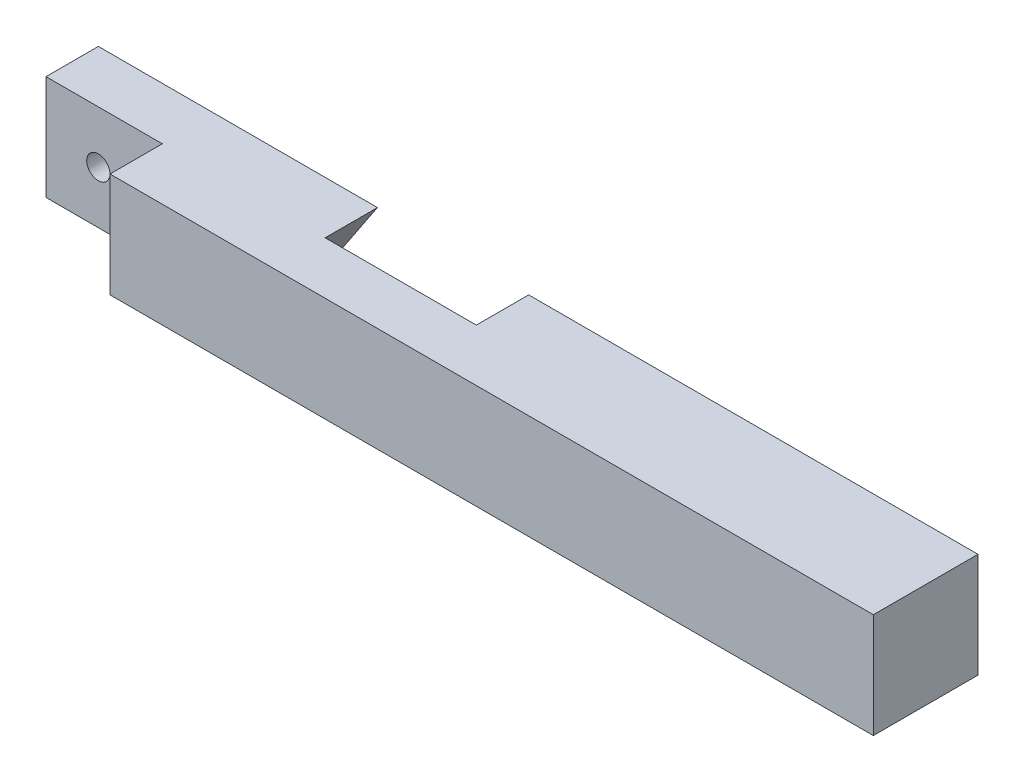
SolidWorks part; units mm, degrees
ref_plane "Plan de face" through (0, 0, 0) normal (0, 0, 1) x (1, 0, 0)
ref_plane "Plan de dessus" through (0, 0, 0) normal (0, 1, 0) x (1, 0, 0)
ref_plane "Plan de droite" through (0, 0, 0) normal (1, 0, 0) x (0, 0, -1)
sketch "Esquisse1" plane through (0, 0, 0) normal (0, 0, 1) x (1, 0, 0)
  line L1 (0, 0) -> (75.63, 0)
  line L2 (0, 0) -> (0, 9)
  line L3 (0, 9) -> (75.63, 9)
  line L4 (75.63, 0) -> (75.63, 9)
  dimension "D1" = 75.63
  dimension "D2" = 9
extrude "Extrusion1" add sketch "Esquisse1" along normal blind 9
sketch "Esquisse2" plane through (0, 0, 9) normal (0, 0, 1) x (1, 0, 0)
  line L0 (0, 0) -> (75.63, 0) construction
  line L1 (0, 9) -> (10, 9)
  line L2 (0, 9) -> (0, 0)
  line L3 (0, 0) -> (10, 0)
  line L4 (10, 9) -> (10, 0)
  dimension "D1" = 10
extrude "Enlèv. mat.-Extru.1" cut sketch "Esquisse2" against normal blind 4.5
sketch "Esquisse3" plane through (0, 0, 4.5) normal (0, 0, 1) x (1, 0, 0)
  line L0 (0, 9) -> (0, 0) construction
  line L1 (0, 0) -> (10, 0) construction
  circle A0 centre (4.5, 4.5) radius 1
  dimension "D3" = 2
  dimension "D1" = 4.5
  dimension "D2" = 4.5
extrude "Enlèv. mat.-Extru.2" cut sketch "Esquisse3" against normal blind 4.5
sketch "Esquisse4" plane through (0, 0, 0) normal (0, 0, -1) x (-1, 0, 0)
  line L0 (-18, 0) -> (-24, 9)
  line L1 (0, 0) -> (-75.63, 0) construction
  line L2 (-75.63, 9) -> (0, 9) construction
  line L3 (-24, 9) -> (-37, 9)
  line L4 (-37, 9) -> (-31, 0)
  line L5 (-31, 0) -> (-18, 0)
  dimension "D1" = 13
  dimension "D2" = 18
  dimension "D3" = 24
extrude "Enlèv. mat.-Extru.3" cut sketch "Esquisse4" against normal blind 4.5
